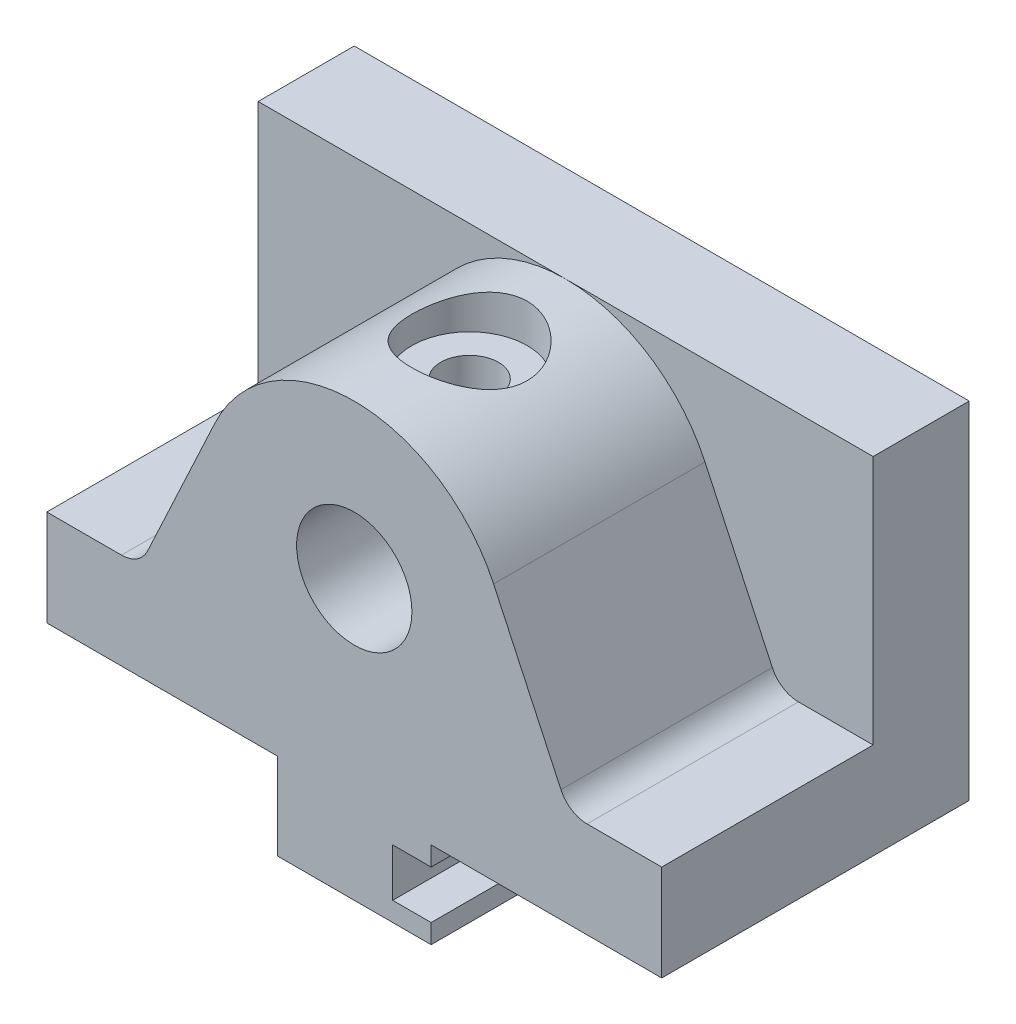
SolidWorks part; units mm, degrees
ref_plane "Front Plane" through (0, 0, 0) normal (0, 0, 1) x (1, 0, 0)
ref_plane "Top Plane" through (0, 0, 0) normal (0, 1, 0) x (1, 0, 0)
ref_plane "Right Plane" through (0, 0, 0) normal (1, 0, 0) x (0, 0, -1)
sketch "Sketch1" plane through (0, 0, 0) normal (0, 0, 1) x (1, 0, 0)
  line L0 (0, 0) -> (0, 40.9271) construction
  line L1 (-32, 0) -> (-8, 0)
  line L2 (-8, 0) -> (-8, -9)
  line L3 (-8, -9) -> (8, -9)
  line L4 (8, -9) -> (8, 0)
  line L5 (8, 0) -> (32, 0)
  line L6 (32, 0) -> (32, 10)
  line L7 (32, 10) -> (22.3171, 10)
  line L8 (22.3171, 10) -> (14.5009, 26.7619)
  line L9 (-14.5009, 26.7619) -> (-22.3171, 10)
  line L10 (-22.3171, 10) -> (-32, 10)
  line L11 (-32, 10) -> (-32, 0)
  arc A0 (14.5009, 26.7619) -> (-14.5009, 26.7619) centre (0, 20) ccw
  dimension "D7" = 16
  dimension "D1" = 16
  dimension "D2" = 64
  dimension "D3" = 10
  dimension "D4" = 9
  dimension "D5" = 36
  dimension "D6" = 50
extrude "Boss-Extrude1" add sketch "Sketch1" along normal blind 22
sketch "Sketch2" plane through (0, 0, 0) normal (0, 0, -1) x (-1, 0, 0)
  line L0 (-32, 0) -> (-32, 10) construction
  line L1 (-8, 0) -> (-32, 0) construction
  line L2 (-8, -9) -> (-8, 0) construction
  line L3 (8, -9) -> (-8, -9) construction
  line L4 (8, 0) -> (8, -9) construction
  line L5 (32, 0) -> (8, 0) construction
  line L6 (32, 10) -> (32, 0) construction
  line L7 (-32, 0) -> (-32, 10)
  line L8 (-8, 0) -> (-32, 0)
  line L9 (-8, -9) -> (-8, 0)
  line L10 (8, -9) -> (-8, -9)
  line L11 (8, 0) -> (8, -9)
  line L12 (32, 0) -> (8, 0)
  line L13 (32, 10) -> (32, 0)
  line L14 (-32, 36) -> (32, 36)
  line L15 (-32, 36) -> (-32, 10)
  line L17 (32, 36) -> (32, 10)
  arc A0 (14.5009, 26.7619) -> (-14.5009, 26.7619) centre (0, 20) ccw construction
extrude "Boss-Extrude2" add sketch "Sketch2" along normal blind 10
fillet "Fillet1" radius 3 2 edges at (-22.3171, 10, 11) (22.3171, 10, 11)
sketch "Sketch3" plane through (0, 0, 22) normal (0, 0, 1) x (1, 0, 0)
  circle A0 centre (0, 20) radius 6
  arc A1 (14.5009, 26.7619) -> (-14.5009, 26.7619) centre (0, 20) ccw construction
  dimension "D1" = 12
extrude "Cut-Extrude1" cut sketch "Sketch3" against normal blind 24
hole_wizard "M6x1.0 Tapped Hole1" positions "Sketch5" profile "Sketch4" tap size "M6x1.0" standard "ANSI Metric"
sketch "Sketch5" plane through (0, -9, 0) normal (0, -1, 0) x (1, 0, 0)
  line L0 (-8, 22) -> (8, 22) construction
  point P0 (0, 14)
  point P1 (0, -2)
  dimension "D1" = 8
  dimension "D2" = 16
sketch "Sketch4" plane through (0, -9, 14) normal (1, 0, 0) x (0, 0, -1)
  line L0 (0, 0) -> (0, 18.8026)
  line L1 (0, 18.8026) -> (3, 17)
  line L2 (3, 17) -> (3, 0)
  line L5 (3, 0) -> (0, 0)
  line L10 (0, 18.8026) -> (-3, 17) construction
  line L11 (0, -6.35) -> (0, 107.95) construction
  dimension "Tap Drill Dia." = 6
  dimension "Tap Drill Depth" = 17
  dimension "Drill Angle" = 118
hole_wizard "Hole1" positions "Sketch12" profile "Sketch11" legacy
sketch "Sketch12" plane through (0, 36, 0) normal (0, 1, 0) x (-1, 0, 0)
  line L0 (32, -10) -> (-32, -10) construction
  point P0 (0, 10)
  dimension "D1" = 20
sketch "Sketch11" plane through (0, 36, 10) normal (1, 0, 0) x (0, 0, 1)
  line L0 (0, 0) -> (0, 17.8016)
  line L1 (0, 17.8016) -> (3, 15.999)
  line L2 (3, 15.999) -> (3, 4)
  line L3 (3, 4) -> (6, 4)
  line L4 (6, 0) -> (0, 0)
  line L5 (0, -11.3109) -> (0, 121.1557) construction
  line L6 (0, 17.8016) -> (-3, 15.999) construction
  line L7 (6, 4) -> (6, 0)
  dimension "Depth" = 15.999
  dimension "Drill Angle" = 118
  dimension "Diameter" = 6
  dimension "C-Bore Diameter" = 12
  dimension "C-Bore Depth" = 4
sketch "Sketch13" plane through (0, 0, 22) normal (0, 0, 1) x (1, 0, 0)
  line L0 (8, -9) -> (8, 0) construction
  line L1 (4, -2) -> (8, -2)
  line L2 (4, -2) -> (4, -7)
  line L3 (4, -7) -> (8, -7)
  line L4 (8, -2) -> (8, -7)
  line L5 (-8, -9) -> (8, -9) construction
  dimension "D1" = 2
  dimension "D2" = 4
  dimension "D3" = 5
extrude "Cut-Extrude2" cut sketch "Sketch13" against normal through all
